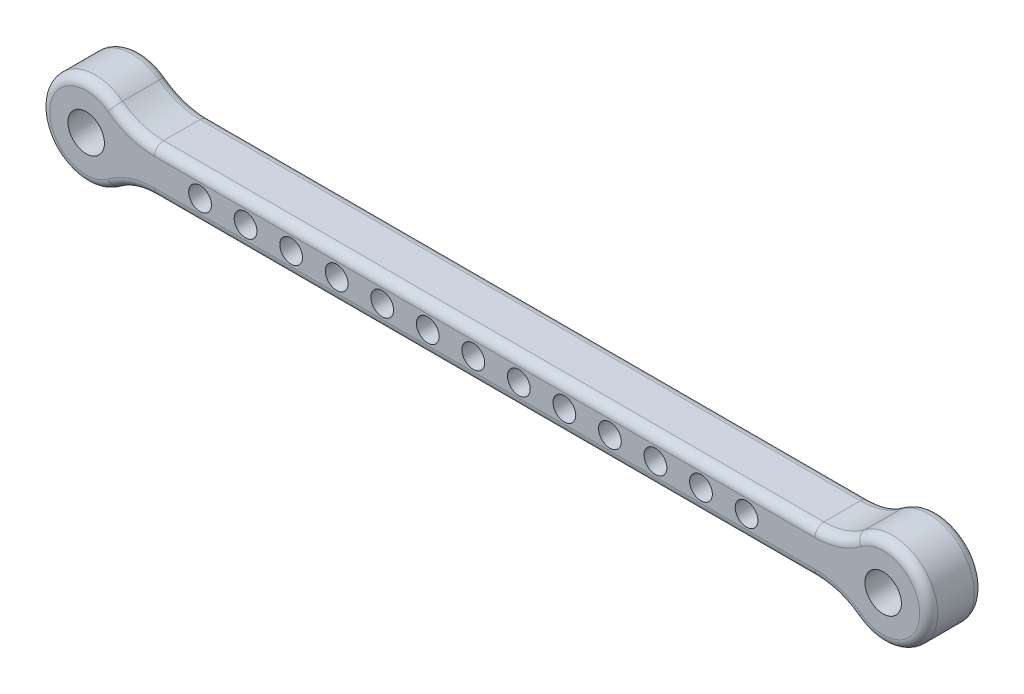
SolidWorks part; units mm, degrees
ref_plane "Ön Düzlem" through (0, 0, 0) normal (0, 0, 1) x (1, 0, 0)
ref_plane "Üst Düzlem" through (0, 0, 0) normal (0, 1, 0) x (1, 0, 0)
ref_plane "Sağ Düzlem" through (0, 0, 0) normal (1, 0, 0) x (0, 0, -1)
sketch "Çizim1" plane through (0, 0, 0) normal (0, 0, 1) x (1, 0, 0)
  line L3 (-160, -5) -> (-15, -5)
  line L5 (-15, 5) -> (-160, 5)
  arc A0 (-6, -8) -> (-6, 8) centre (0, 0) ccw
  arc A1 (-169, 8) -> (-169, -8) centre (-175, 0) ccw
  arc A2 (-15, 5) -> (-6, 8) centre (-15, 20) ccw
  arc A3 (-15, -5) -> (-6, -8) centre (-15, -20) cw
  arc A4 (-169, -8) -> (-160, -5) centre (-160, -20) cw
  arc A5 (-169, 8) -> (-160, 5) centre (-160, 20) ccw
  circle A6 centre (-175, 0) radius 4
  circle A7 centre (0, 0) radius 4
  circle A8 centre (-150, 0) radius 2.5
  circle A9 centre (-140, 0) radius 2.5
  circle A10 centre (-130, 0) radius 2.5
  circle A11 centre (-120, 0) radius 2.5
  circle A12 centre (-110, 0) radius 2.5
  circle A13 centre (-100, 0) radius 2.5
  circle A14 centre (-90, 0) radius 2.5
  circle A15 centre (-80, 0) radius 2.5
  circle A16 centre (-70, 0) radius 2.5
  circle A17 centre (-60, 0) radius 2.5
  circle A18 centre (-50, 0) radius 2.5
  circle A19 centre (-40, 0) radius 2.5
  circle A20 centre (-30, 0) radius 2.5
  dimension "D1" = 15
  dimension "D2" = 25
  dimension "D3" = 13
extrude "Yükseklik-Ekstrüzyon1" add sketch "Çizim1" along normal blind 12
fillet "Radyus1" radius 2 16 edges at (-164.7434, 5.7698, 0) (-87.5, 5, 0) (-10.2566, 5.7698, 0) (10, 0, 0) (-10.2566, -5.7698, 0) (-87.5, -5, 0) (-164.7434, -5.7698, 0) (-164.7434, 5.7698, 12) (-87.5, 5, 12) (-10.2566, 5.7698, 12) (10, 0, 12) (-10.2566, -5.7698, 12) (-87.5, -5, 12) (-164.7434, -5.7698, 12) (-185, 0, 0) (-185, 0, 12)
